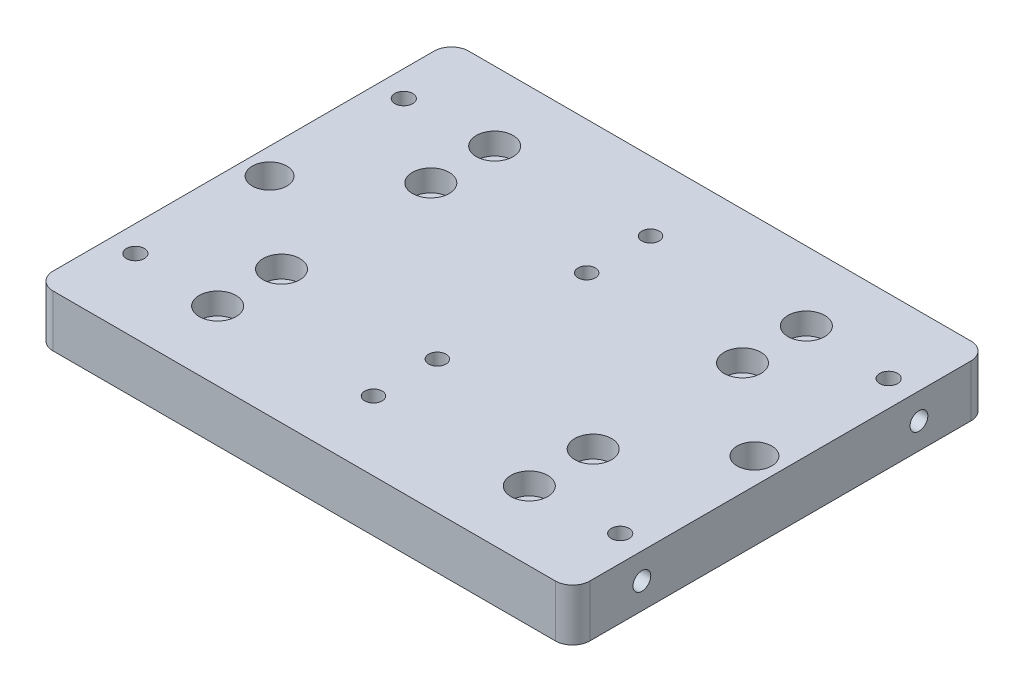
SolidWorks part; units mm, degrees
ref_plane "Front Plane" through (0, 0, 0) normal (0, 0, 1) x (1, 0, 0)
ref_plane "Top Plane" through (0, 0, 0) normal (0, 1, 0) x (1, 0, 0)
ref_plane "Right Plane" through (0, 0, 0) normal (1, 0, 0) x (0, 0, -1)
sketch "Sketch1" plane through (0, 0, 0) normal (0, 1, 0) x (1, 0, 0)
  line L1 (-98.425, 76.2) -> (98.425, 76.2)
  line L2 (-98.425, 76.2) -> (-98.425, -76.2)
  line L3 (-98.425, -76.2) -> (98.425, -76.2)
  line L4 (98.425, 76.2) -> (98.425, -76.2)
  line L5 (-98.425, 76.2) -> (98.425, -76.2) construction
  line L6 (-98.425, -76.2) -> (98.425, 76.2) construction
  point P0 (0, 0)
  dimension "D1" = 196.85
  dimension "D2" = 152.4
extrude "Boss-Extrude1" add sketch "Sketch1" along normal blind 19.05
hole_wizard "CBORE for 5/16 Socket Head Cap Screw2" positions "Sketch2" profile "Sketch3" counterbore size "5/16" standard "ANSI Inch"
sketch "Sketch2" plane through (0, 19.05, 0) normal (0, 1, 0) x (1, 0, 0)
  point P0 (-57.15, 27.3812)
  point P3 (57.15, 27.3812)
  point P6 (57.15, -27.3812)
  point P9 (-57.15, -27.3812)
sketch "Sketch3" plane through (-57.15, 19.05, -27.3812) normal (1, 0, 0) x (0, 0, 1)
  line L0 (0, 0) -> (0, 19.05)
  line L1 (0, 19.05) -> (4.2164, 19.05)
  line L3 (4.2164, 19.05) -> (4.2164, 7.9375)
  line L4 (4.2164, 7.9375) -> (6.7475, 7.9375)
  line L5 (6.7475, 7.9375) -> (6.7475, 0)
  line L7 (6.7475, 0) -> (0, 0)
  line L11 (0, -6.35) -> (0, 107.95) construction
  dimension "Thru Hole Dia." = 8.4328
  dimension "Thru Hole Depth" = 19.05
  dimension "C'Bore Dia." = 13.495
  dimension "C'Bore Depth" = 7.9375
hole_wizard "1/4 (0.2500) Dowel Hole1" positions "Sketch4" profile "Sketch5" hole size "1/4" standard "ANSI Inch"
sketch "Sketch4" plane through (0, 19.05, 0) normal (0, 1, 0) x (1, 0, 0)
  point P0 (0, -27.3812)
  point P3 (0, 27.3812)
sketch "Sketch5" plane through (0, 19.05, 27.3812) normal (1, 0, 0) x (0, 0, 1)
  line L0 (0, 0) -> (0, 19.05)
  line L1 (0, 19.05) -> (3.175, 19.05)
  line L2 (3.175, 19.05) -> (3.175, 0)
  line L5 (3.175, 0) -> (0, 0)
  line L11 (0, -6.35) -> (0, 107.95) construction
  dimension "Thru Hole Dia." = 6.35
  dimension "Thru Hole Depth" = 19.05
hole_wizard "5/16-18 Tapped Hole2" positions "Sketch6" profile "Sketch7" tap size "5/16-18" standard "ANSI Inch"
sketch "Sketch6" plane through (0, 19.05, 0) normal (0, 1, 0) x (1, 0, 0)
  point P0 (-88.9, 49.2125)
  point P3 (-88.9, -49.2125)
  point P6 (88.9, -49.2125)
  point P9 (88.9, 49.2125)
sketch "Sketch7" plane through (-88.9, 19.05, -49.2125) normal (1, 0, 0) x (0, 0, 1)
  line L0 (0, 0) -> (0, 19.05)
  line L1 (0, 19.05) -> (3.2639, 19.05)
  line L2 (3.2639, 19.05) -> (3.2639, 0)
  line L5 (3.2639, 0) -> (0, 0)
  line L11 (0, -6.35) -> (0, 107.95) construction
  dimension "Thru Tap Drill Dia." = 6.5278
  dimension "Thru Tap Drill Depth" = 19.05
hole_wizard "1/2 (0.5000) Dowel Hole1" positions "Sketch8" profile "Sketch9" hole size "1/2" standard "ANSI Inch"
sketch "Sketch8" plane through (0, 19.05, 0) normal (0, 1, 0) x (1, 0, 0)
  point P0 (-88.9, 0)
  point P3 (88.9, 0)
sketch "Sketch9" plane through (-88.9, 19.05, 0) normal (1, 0, 0) x (0, 0, 1)
  line L0 (0, 0) -> (0, 19.05)
  line L1 (0, 19.05) -> (6.35, 19.05)
  line L2 (6.35, 19.05) -> (6.35, 0)
  line L5 (6.35, 0) -> (0, 0)
  line L11 (0, -6.35) -> (0, 107.95) construction
  dimension "Thru Hole Dia." = 12.7
  dimension "Thru Hole Depth" = 19.05
hole_wizard "CBORE for 5/16 Socket Head Cap Screw1" positions "Sketch10" profile "Sketch11" counterbore size "5/16" standard "ANSI Inch"
sketch "Sketch10" plane through (0, 19.05, 0) normal (0, 1, 0) x (1, 0, 0)
  point P0 (57.15, 50.8)
  point P3 (-57.15, 50.8)
  point P6 (-57.15, -50.8)
  point P9 (57.15, -50.8)
sketch "Sketch11" plane through (57.15, 19.05, -50.8) normal (1, 0, 0) x (0, 0, 1)
  line L0 (0, 0) -> (0, 19.05)
  line L1 (0, 19.05) -> (4.2164, 19.05)
  line L3 (4.2164, 19.05) -> (4.2164, 7.9375)
  line L4 (4.2164, 7.9375) -> (6.7475, 7.9375)
  line L5 (6.7475, 7.9375) -> (6.7475, 0)
  line L7 (6.7475, 0) -> (0, 0)
  line L11 (0, -6.35) -> (0, 107.95) construction
  dimension "Thru Hole Dia." = 8.4328
  dimension "Thru Hole Depth" = 19.05
  dimension "C'Bore Dia." = 13.495
  dimension "C'Bore Depth" = 7.9375
hole_wizard "1/4 (0.2500) Dowel Hole2" positions "Sketch12" profile "Sketch13" hole size "1/4" standard "ANSI Inch"
sketch "Sketch12" plane through (0, 0, 0) normal (0, -1, 0) x (-1, 0, 0)
  point P0 (0, 50.8)
  point P3 (0, -50.8)
sketch "Sketch13" plane through (0, 0, -50.8) normal (1, 0, 0) x (0, 0, -1)
  line L0 (0, 0) -> (0, 19.05)
  line L1 (0, 19.05) -> (3.175, 19.05)
  line L2 (3.175, 19.05) -> (3.175, 0)
  line L5 (3.175, 0) -> (0, 0)
  line L11 (0, -6.35) -> (0, 107.95) construction
  dimension "Thru Hole Dia." = 6.35
  dimension "Thru Hole Depth" = 19.05
sketch "Sketch14" plane through (98.425, 0, 0) normal (1, 0, 0) x (0, 0, -1)
  line L4 (-76.2, 0) -> (76.2, 0)
  line L5 (76.2, 0) -> (76.2, 19.05)
  line L6 (76.2, 19.05) -> (-76.2, 19.05)
  line L9 (76.2, 0) -> (76.2, 19.05)
  line L10 (76.2, 19.05) -> (-76.2, 19.05)
  line L12 (-76.2, 0) -> (76.2, 0)
  line L14 (-76.2, 19.05) -> (-76.2, 0)
  line L15 (-76.2, 19.05) -> (-76.2, 0)
  dimension "D1" = 0
hole_wizard "5/16-18 Tapped Hole1" positions "Sketch15" profile "Sketch16" tap size "5/16-18" standard "ANSI Inch"
sketch "Sketch15" plane through (-98.425, 0, 15.875) normal (1, 0, 0) x (0, 0, -1)
  line L0 (66.675, 9.525) -> (-34.925, 9.525) construction
  line L2 (92.075, 19.05) -> (92.075, 0) construction
  line L3 (66.675, 9.525) -> (92.075, 9.525) construction
  line L5 (15.875, 9.525) -> (15.875, 0) construction
  line L6 (92.075, 0) -> (-60.325, 0) construction
  point P0 (-34.925, 9.525)
  point P3 (66.675, 9.525)
  dimension "D1" = 25.4
sketch "Sketch16" plane through (-98.425, 9.525, 50.8) normal (0, 1, 0) x (0, 0, 1)
  line L0 (0, 0) -> (0, 17.9631)
  line L1 (0, 17.9631) -> (3.2639, 16.002)
  line L2 (3.2639, 16.002) -> (3.2639, 0)
  line L5 (3.2639, 0) -> (0, 0)
  line L10 (0, 17.9631) -> (-3.2639, 16.002) construction
  line L11 (0, -6.35) -> (0, 107.95) construction
  dimension "Tap Drill Dia." = 6.5278
  dimension "Tap Drill Depth" = 16.002
  dimension "Drill Angle" = 118
fillet "Fillet1" radius 6.35 4 edges at (-98.425, 9.525, 76.2) (-98.425, 9.525, -76.2) (98.425, 9.525, -76.2) (98.425, 9.525, 76.2)
mirror "Mirror1" about plane through (0, 0, 0) normal (1, 0, 0) of "5/16-18 Tapped Hole1"
